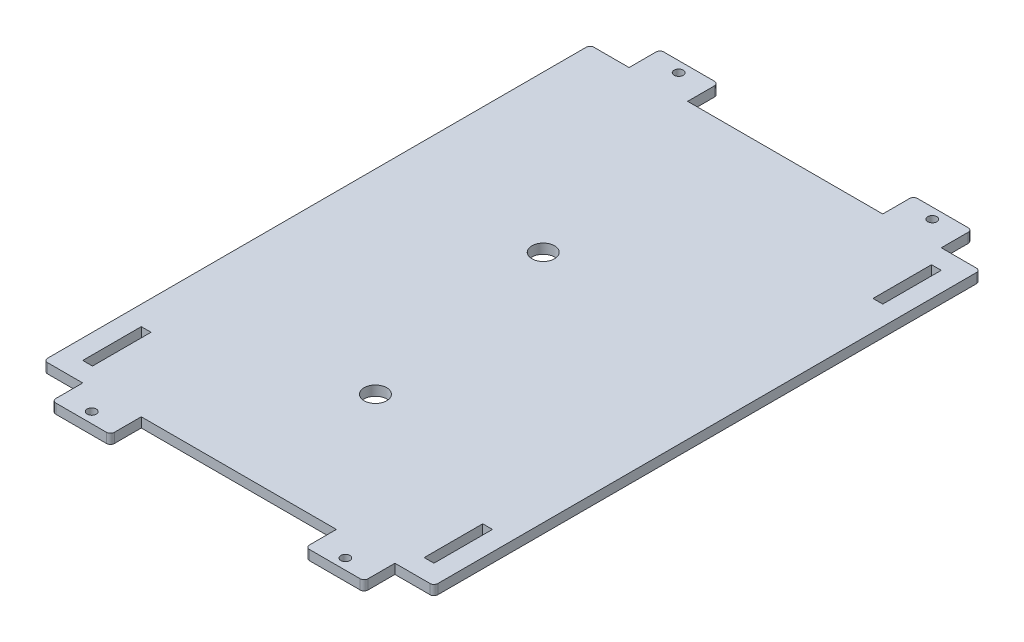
SolidWorks part; units mm, degrees
ref_plane "Front Plane" through (0, 0, 0) normal (0, 0, 1) x (1, 0, 0)
ref_plane "Top Plane" through (0, 0, 0) normal (0, 1, 0) x (1, 0, 0)
ref_plane "Right Plane" through (0, 0, 0) normal (1, 0, 0) x (0, 0, -1)
sketch "Sketch1" plane through (0, 0, 0) normal (0, 1, 0) x (1, 0, 0)
  line L0 (127, 0) -> (127, 177.8)
  line L1 (0, 0) -> (127, 0)
  line L2 (0, 0) -> (0, 177.8)
  line L3 (127, 177.8) -> (0, 177.8)
  dimension "D1" = 127
  dimension "D2" = 177.8
extrude "Boss-Extrude1" add sketch "Sketch1" along normal blind 3.175
sketch "Sketch2" plane through (0, 0, 0) normal (0, 1, 0) x (1, 0, 0)
  line L0 (127, 177.8) -> (0, 177.8) construction
  line L1 (12.7, 177.8) -> (31.75, 177.8)
  line L2 (12.7, 177.8) -> (12.7, 187.833)
  line L3 (12.7, 187.833) -> (31.75, 187.833)
  line L4 (31.75, 177.8) -> (31.75, 187.833)
  line L5 (63.5, 0) -> (63.5, 177.8) construction
  line L6 (0, 0) -> (127, 0) construction
  line L7 (114.3, 177.8) -> (114.3, 187.833)
  line L8 (114.3, 187.833) -> (95.25, 187.833)
  line L9 (95.25, 177.8) -> (95.25, 187.833)
  line L10 (0, 88.9) -> (127, 88.9) construction
  line L11 (0, 177.8) -> (0, 0) construction
  line L12 (127, 0) -> (127, 177.8) construction
  line L13 (114.3, 0) -> (114.3, -10.033)
  line L14 (114.3, -10.033) -> (95.25, -10.033)
  line L15 (95.25, 0) -> (95.25, -10.033)
  line L16 (12.7, 0) -> (12.7, -10.033)
  line L17 (12.7, -10.033) -> (31.75, -10.033)
  line L18 (31.75, 0) -> (31.75, -10.033)
  line L19 (114.3, 177.8) -> (95.25, 177.8)
  line L20 (114.3, 0) -> (95.25, 0)
  line L21 (12.7, 0) -> (31.75, 0)
  dimension "D1" = 19.05
  dimension "D2" = 12.7
  dimension "D3" = 10.033
extrude "Boss-Extrude2" add sketch "Sketch2" along normal blind 3.175
sketch "Sketch3" plane through (0, 3.175, 0) normal (0, 1, 0) x (1, 0, 0)
  line L0 (127, 0) -> (127, 177.8) construction
  line L1 (117.475, 171.45) -> (120.65, 171.45)
  line L2 (117.475, 171.45) -> (117.475, 152.4)
  line L3 (117.475, 152.4) -> (120.65, 152.4)
  line L4 (120.65, 171.45) -> (120.65, 152.4)
  line L5 (0, 88.9) -> (127, 88.9) construction
  line L6 (0, 177.8) -> (0, 0) construction
  line L7 (120.65, 6.35) -> (120.65, 25.4)
  line L8 (117.475, 25.4) -> (120.65, 25.4)
  line L9 (117.475, 6.35) -> (117.475, 25.4)
  line L10 (117.475, 6.35) -> (120.65, 6.35)
  line L11 (63.5, 177.8) -> (63.5, 0) construction
  line L12 (95.25, 177.8) -> (31.75, 177.8) construction
  line L13 (31.75, 0) -> (95.25, 0) construction
  line L14 (9.525, 6.35) -> (6.35, 6.35)
  line L15 (9.525, 6.35) -> (9.525, 25.4)
  line L16 (9.525, 25.4) -> (6.35, 25.4)
  line L17 (6.35, 6.35) -> (6.35, 25.4)
  dimension "D1" = 3.175
  dimension "D2" = 6.35
  dimension "D3" = 19.05
  dimension "D4" = 6.35
extrude "Cut-Extrude1" cut sketch "Sketch3" against normal blind 3.175
sketch "Sketch4" plane through (0, 3.175, 0) normal (0, 1, 0) x (1, 0, 0)
  line L0 (50.8, 177.8) -> (50.8, 111.76) construction
  line L1 (95.25, 177.8) -> (31.75, 177.8) construction
  line L2 (31.75, 0) -> (95.25, 0) construction
  line L3 (0, 177.8) -> (0, 0) construction
  circle A0 centre (50.8, 111.76) radius 3.683
  circle A1 centre (63.5, 44.45) radius 3.683
  point P7 (63.5, 0)
  dimension "D2" = 7.366
  dimension "D4" = 7.366
  dimension "D1" = 66.04
  dimension "D3" = 44.45
  dimension "D5" = 50.8
extrude "Cut-Extrude2" cut sketch "Sketch4" against normal through all
hole_wizard "#4 Clearance Hole1" positions "Sketch6" profile "Sketch5" hole size "#4" standard "ANSI Inch"
sketch "Sketch6" plane through (0, 3.175, 0) normal (0, 1, 0) x (1, 0, 0)
  line L0 (31.75, 187.833) -> (12.7, 187.833) construction
  line L2 (114.3, 187.833) -> (95.25, 187.833) construction
  line L3 (0, 88.9) -> (127, 88.9) construction
  line L4 (0, 177.8) -> (0, 0) construction
  line L5 (127, 0) -> (127, 177.8) construction
  line L6 (12.7, 177.8) -> (0, 177.8) construction
  point P0 (22.225, 184.404)
  point P2 (104.775, 184.404)
  point P7 (22.225, 187.833)
  point P14 (104.775, 187.833)
  point P23 (22.225, -6.604)
  point P24 (104.775, -6.604)
  dimension "D1" = 6.604
sketch "Sketch5" plane through (22.225, 3.175, -184.404) normal (1, 0, 0) x (0, 0, 1)
  line L0 (0, 0) -> (0, 3.1751)
  line L1 (0, 3.1751) -> (1.4732, 3.1751)
  line L2 (1.4732, 3.1751) -> (1.4732, 0)
  line L5 (1.4732, 0) -> (0, 0)
  line L11 (0, -6.35) -> (0, 107.95) construction
  dimension "Thru Hole Dia." = 2.9464
  dimension "Thru Hole Depth" = 3.1751
fillet "Fillet1" radius 1.27 12 edges at (0, 1.5875, 0) (12.7, 1.5875, 10.033) (31.75, 1.5875, 10.033) (95.25, 1.5875, 10.033) (114.3, 1.5875, 10.033) (127, 1.5875, 0) (127, 1.5875, -177.8) (114.3, 1.5875, -187.833) (95.25, 1.5875, -187.833) (0, 1.5875, -177.8) (31.75, 1.5875, -187.833) (12.7, 1.5875, -187.833)
